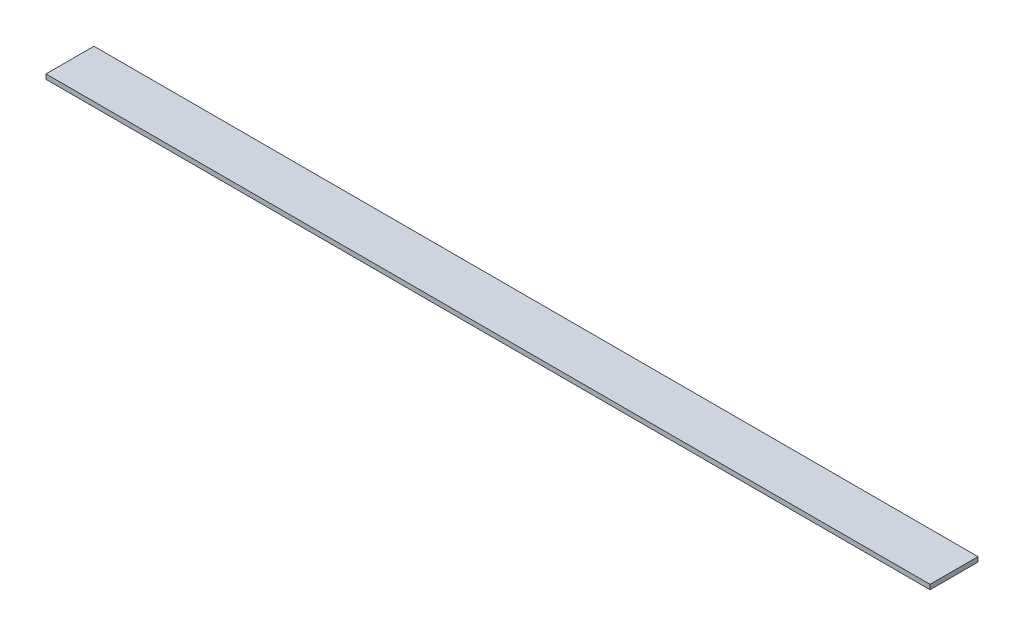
SolidWorks part; units mm, degrees
ref_plane "Front Plane" through (0, 0, 0) normal (0, 0, 1) x (1, 0, 0)
ref_plane "Top Plane" through (0, 0, 0) normal (0, 1, 0) x (1, 0, 0)
ref_plane "Right Plane" through (0, 0, 0) normal (1, 0, 0) x (0, 0, -1)
ref_plane "Plane1" through (0, 10, 0) normal (0, 1, 0) x (-1, 0, 0)
sketch "Sketch1" plane through (0, 10, 0) normal (0, 1, 0) x (-1, 0, 0)
  line L0 (-936.625, 50.8) -> (-936.625, -50.8)
  line L1 (-936.625, -50.8) -> (936.625, -50.8)
  line L2 (936.625, -50.8) -> (936.625, 50.8)
  line L3 (936.625, 50.8) -> (-936.625, 50.8)
extrude "Boss-Extrude1" add sketch "Sketch1" against normal blind 10
